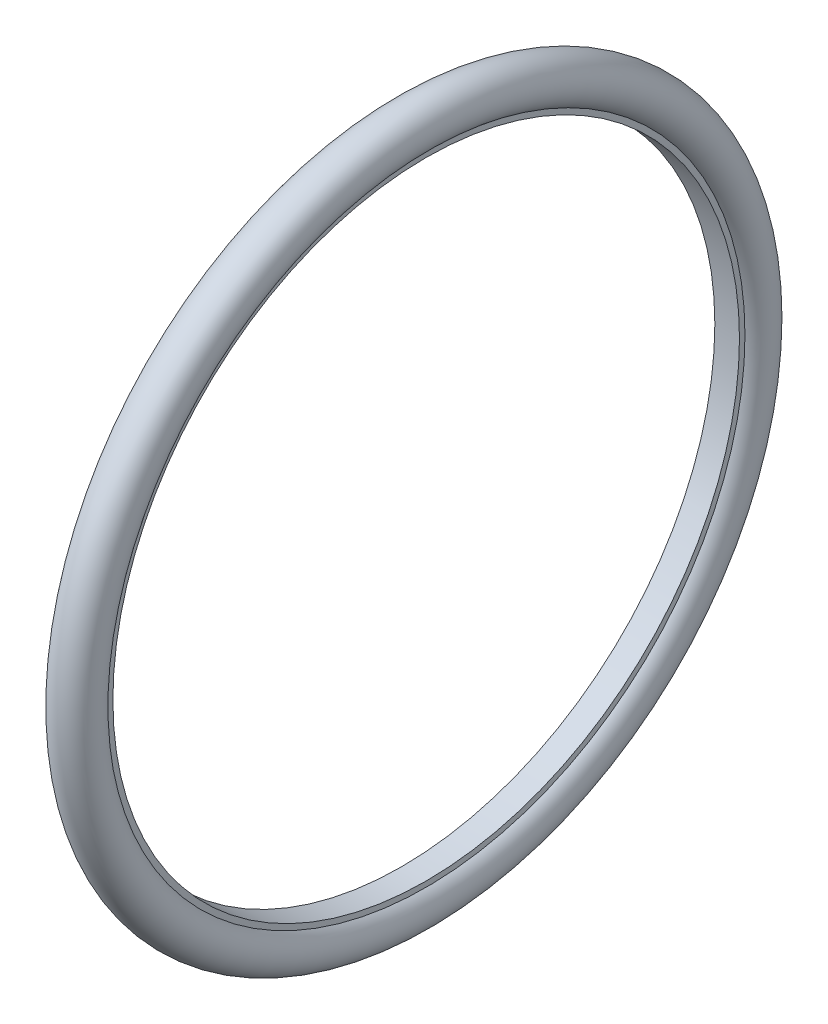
SolidWorks part; units mm, degrees
ref_plane "Face" through (0, 0, 0) normal (0, 0, 1) x (1, 0, 0)
ref_plane "Dessus" through (0, 0, 0) normal (0, 1, 0) x (1, 0, 0)
ref_plane "Droite" through (0, 0, 0) normal (1, 0, 0) x (0, 0, -1)
sketch "Esquisse1" plane through (0, 0, 0) normal (0, 0, 1) x (1, 0, 0)
  line L4 (49.05, 290) -> (71.45, 290) construction
  line L5 (49.05, -290) -> (49.05, 290) construction
  line L6 (71.45, 290) -> (71.45, -290) construction
  line L8 (60.25, 290) -> (60.25, 313.1684) construction
  line L9 (72.75, 290) -> (71.45, 290) construction
  line L10 (88.7011, 0) -> (70.0832, 0) construction
  line L11 (-10, 0) -> (160, 0) construction
  line L12 (49.05, 290) -> (49.05, 285)
  line L13 (49.05, 285) -> (71.45, 285)
  line L14 (71.45, 290) -> (71.45, 285)
  arc A0 (71.45, 290) -> (49.05, 290) centre (60.25, 306.5699) ccw
  dimension "D1" = 40
  dimension "D2" = 5
revolve "Révolution1" add sketch "Esquisse1" angle 360 about L10
sketch "contact sol" plane through (0, 0, 0) normal (0, 0, 1) x (1, 0, 0)
  line L0 (60.25, 290) -> (60.25, 313.1684) construction
  arc A0 (71.45, 290) -> (49.05, 290) centre (60.25, 306.5699) ccw construction
  point P0 (60.25, 326.5699)
